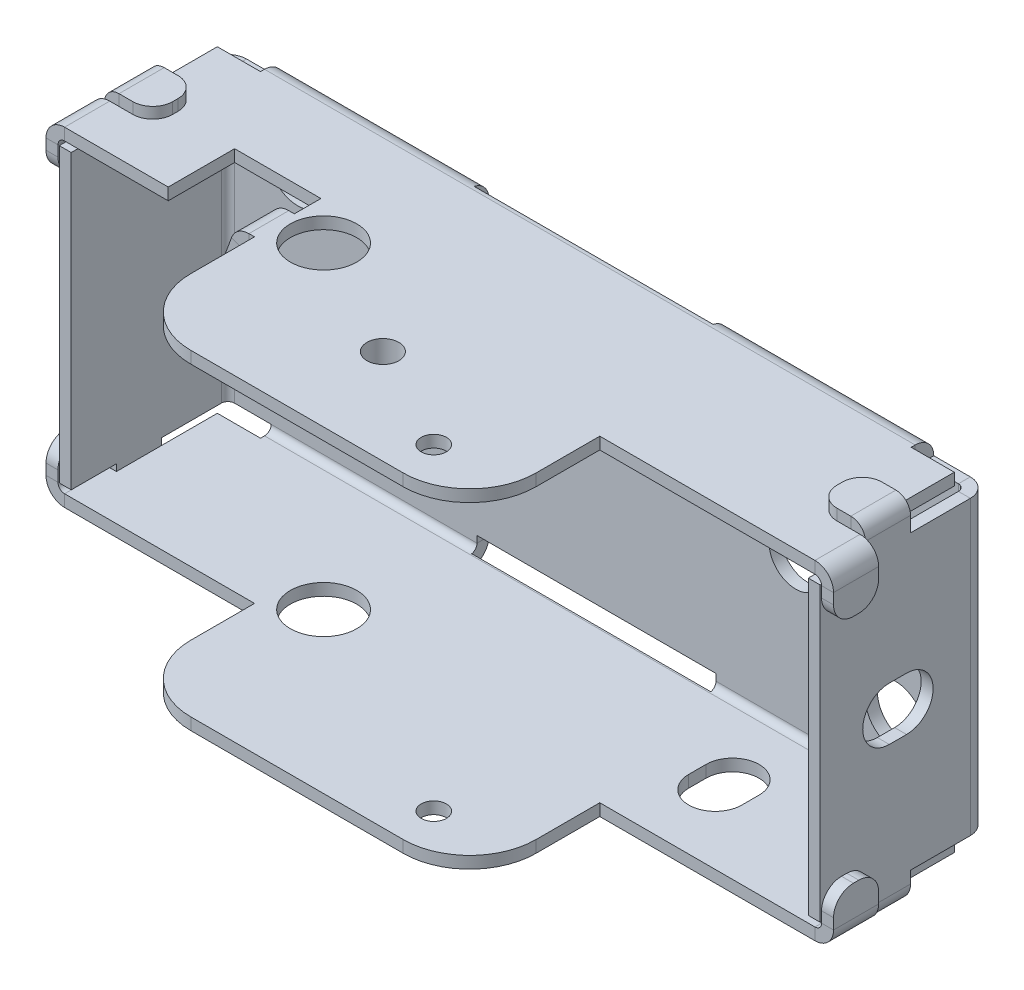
SolidWorks part; units mm, degrees
ref_plane "Plan de face" through (0, 0, 0) normal (0, 0, 1) x (1, 0, 0)
ref_plane "Plan de dessus" through (0, 0, 0) normal (0, 1, 0) x (1, 0, 0)
ref_plane "Plan de droite" through (0, 0, 0) normal (1, 0, 0) x (0, 0, -1)
sketch "Esquisse1" plane through (0, 0, 0) normal (0, 0, 1) x (1, 0, 0)
  line L0 (-24.5, 11) -> (-24.5, 12.8)
  line L1 (-32.05, -23.8) -> (-13.95, -23.8)
  line L2 (-24.5, -12.8) -> (-24.5, -11)
  line L3 (-32.05, 23.8) -> (-20.45, 23.8)
  line L4 (24.5, -12.8) -> (24.5, -11)
  line L5 (-24.5, 11) -> (-33.25, 11)
  line L6 (24.5, 11) -> (24.5, 12.8)
  line L7 (-24.5, -11) -> (-33.25, -11)
  line L8 (-40.05, 11) -> (-40.05, -11)
  line L9 (24.5, 11) -> (33.25, 11)
  line L10 (32.05, 23.8) -> (32.05, 20.4)
  line L11 (24.5, -11) -> (33.25, -11)
  line L12 (40.05, 11) -> (40.05, -11)
  line L13 (-32.05, 23.8) -> (-32.05, 20.4)
  line L14 (-27.75, 12.8) -> (-24.5, 12.8)
  line L15 (0, -23.8) -> (0, 23.8) construction
  line L16 (-32.05, -23.8) -> (-32.05, -20.4)
  line L17 (27.75, 12.8) -> (24.5, 12.8)
  line L18 (-27.75, -12.8) -> (-24.5, -12.8)
  line L19 (40.05, 0) -> (-40.05, 0) construction
  line L20 (32.05, -23.8) -> (32.05, -20.4)
  line L21 (27.75, -12.8) -> (24.5, -12.8)
  line L22 (-27.75, 12.8) -> (-27.75, 20.4)
  line L23 (-9, 10.5) -> (9, 10.5)
  line L24 (-9, 10.5) -> (-9, 12.3)
  line L25 (-9, 12.3) -> (9, 12.3)
  line L26 (9, 10.5) -> (9, 12.3)
  line L27 (-9, -10.5) -> (9, -10.5)
  line L28 (-9, -10.5) -> (-9, -12.3)
  line L29 (-9, -12.3) -> (9, -12.3)
  line L30 (9, -10.5) -> (9, -12.3)
  line L31 (-27.75, 20.4) -> (-32.05, 20.4)
  line L32 (-27.75, -12.8) -> (-27.75, -20.4)
  line L33 (-27.75, -20.4) -> (-32.05, -20.4)
  line L34 (27.75, 12.8) -> (27.75, 20.4)
  line L35 (27.75, 20.4) -> (32.05, 20.4)
  line L36 (27.75, -12.8) -> (27.75, -20.4)
  line L37 (27.75, -20.4) -> (32.05, -20.4)
  line L38 (-36.65, -11) -> (-40.05, -11)
  line L39 (-36.65, 11) -> (-40.05, 11)
  line L40 (-36.65, -11) -> (-36.65, -15.7)
  line L41 (-36.65, -15.7) -> (-33.25, -15.7)
  line L42 (-33.25, -11) -> (-33.25, -15.7)
  line L43 (36.65, 11) -> (40.05, 11)
  line L44 (-36.65, 11) -> (-36.65, 15.7)
  line L45 (-36.65, 15.7) -> (-33.25, 15.7)
  line L46 (-33.25, 11) -> (-33.25, 15.7)
  line L47 (36.65, -11) -> (40.05, -11)
  line L48 (36.65, 11) -> (36.65, 15.7)
  line L49 (36.65, 15.7) -> (33.25, 15.7)
  line L50 (33.25, 11) -> (33.25, 15.7)
  line L51 (0, 10.5) -> (0, -10.5) construction
  line L52 (36.65, -11) -> (36.65, -15.7)
  line L53 (36.65, -15.7) -> (33.25, -15.7)
  line L54 (33.25, -11) -> (33.25, -15.7)
  line L55 (12.05, -23.8) -> (32.05, -23.8)
  line L56 (-32.05, 23.8) -> (32.05, 23.8) construction
  line L57 (-13.95, 23.8) -> (-13.95, 33.6)
  line L58 (-13.95, 33.6) -> (12.05, 33.6)
  line L59 (12.05, 23.8) -> (12.05, 33.6)
  line L60 (12.05, 23.8) -> (32.05, 23.8)
  line L61 (-13.95, -23.8) -> (-13.95, -33.6)
  line L62 (-13.95, -33.6) -> (12.05, -33.6)
  line L63 (12.05, -23.8) -> (12.05, -33.6)
  line L64 (-10.95, 21.6) -> (-10.95, 0) construction
  line L65 (-10.95, 0) -> (-10.95, -21.6) construction
  line L66 (6.3488, -30.6) -> (6.3488, 0) construction
  line L67 (6.3488, 0) -> (6.3488, 30.6) construction
  line L68 (-19.45, 23.8) -> (-19.45, 20.8)
  line L69 (-19.45, 20.8) -> (-13.95, 20.8)
  line L70 (-13.95, 20.8) -> (-13.95, 18.8)
  line L71 (-13.95, 18.8) -> (-20.45, 18.8)
  line L72 (-20.45, 18.8) -> (-20.45, 23.8)
  line L73 (-19.45, 23.8) -> (-13.95, 23.8)
  line L74 (22.5, 6.5) -> (0, 6.5) construction
  line L75 (22.5, -6.5) -> (22.5, 0) construction
  line L76 (22.5, 0) -> (22.5, 6.5) construction
  line L77 (0, 6.5) -> (-22.5, 6.5) construction
  line L78 (-22.5, 6.5) -> (-15, 0) construction
  line L79 (22.5, -6.5) -> (15, 0) construction
  line L80 (36.85, 3.0349) -> (36.85, -3.0249) construction
  line L81 (31.55, -3.0249) -> (31.55, 3.5197) construction
  line L82 (17.5894, -20.6) -> (12.05, -20.6) construction
  line L83 (34.85, -2) -> (33.55, -2)
  line L84 (33.55, 2) -> (34.85, 2)
  line L85 (17.5894, -15.3) -> (12.05, -15.3) construction
  line L86 (13.55, -18.6) -> (13.55, -17.3)
  line L87 (17.55, -18.6) -> (17.55, -17.3)
  circle A0 centre (-10.95, 21.6) radius 2.5
  circle A1 centre (-10.95, -21.6) radius 2.5
  circle A2 centre (6.3488, 30.6) radius 0.95
  circle A3 centre (6.3488, -30.6) radius 0.95
  circle A4 centre (-15, 0) radius 2
  circle A5 centre (15, 0) radius 2
  circle A6 centre (22.5, -6.5) radius 2.25
  circle A7 centre (-22.5, 6.5) radius 2.25
  arc A8 (34.85, -2) -> (34.85, 2) centre (34.85, 0) ccw
  arc A9 (33.55, 2) -> (33.55, -2) centre (33.55, 0) ccw
  arc A10 (13.55, -18.6) -> (17.55, -18.6) centre (15.55, -18.6) ccw
  arc A11 (17.55, -17.3) -> (13.55, -17.3) centre (15.55, -17.3) ccw
  dimension "D24" = 4.5
  dimension "D26" = 4
  dimension "D28" = 4
  dimension "D33" = 4
  dimension "D38" = 1.9
  dimension "D39" = 5
  dimension "D1" = 22
  dimension "D2" = 49
  dimension "D3" = 11
  dimension "D4" = 12.8
  dimension "D5" = 15.55
  dimension "D6" = 3.4
  dimension "D7" = 55.5
  dimension "D8" = 64.1
  dimension "D9" = 3.4
  dimension "D10" = 3.4
  dimension "D11" = 4.7
  dimension "D12" = 21
  dimension "D13" = 9.8
  dimension "D14" = 21.3
  dimension "D15" = 18
  dimension "D16" = 26
  dimension "D17" = 39.8
  dimension "D18" = 3
  dimension "D19" = 6.5
  dimension "D20" = 2
  dimension "D21" = 1
  dimension "D22" = 45
  dimension "D23" = 13
  dimension "D25" = 30
  dimension "D27" = 3.2
  dimension "D29" = 5.3
  dimension "D30" = 3.2
  dimension "D31" = 5.3
  dimension "D32" = 3.5
  dimension "D34" = 12
  dimension "D35" = 3
  dimension "D36" = 3
  dimension "D37" = 19.5
extrude "Extrusion1" add sketch "Esquisse1" along normal blind 0.9
fillet "Congé1" radius 1.5 20 edges at (-19.45, 22.3, 0.9) (-19.45, 22.3, 0) (-32.05, -20.4, 0.45) (-33.25, -15.7, 0.45) (-36.65, -15.7, 0.45) (-36.65, 15.7, 0.45) (-33.25, 15.7, 0.45) (-32.05, 20.4, 0.45) (-32.05, 23.8, 0.45) (-19.45, 20.8, 0.45) (-19.45, 23.8, 0.45) (32.05, 23.8, 0.45) (32.05, 20.4, 0.45) (33.25, 15.7, 0.45) (36.65, 15.7, 0.45) (36.65, -15.7, 0.45) (33.25, -15.7, 0.45) (32.05, -20.4, 0.45) (32.05, -23.8, 0.45) (-32.05, -23.8, 0.45)
fillet "Congé2" radius 5 4 edges at (-13.95, 33.6, 0.45) (12.05, 33.6, 0.45) (12.05, -33.6, 0.45) (-13.95, -33.6, 0.45)
sheet metal parameters "Tôlerie 3" parameters "D1"=0.7366, "Epaisseur"=0.9
flatten bends "Dépliage 1" parameters "D1"=0
sketch "Esquisse-Angle1" plane through (0, 0, 0.9) normal (0, 0, 1) x (1, 0, 0)
process bends "Pliage 1" parameters "D1"=0.2
sketch "Esquisse-Plate1" plane through (0, 0, 0.9) normal (0, 0, 1) x (1, 0, 0)
  line L0 (-24.5, 12.8) -> (-24.5, 11) construction
  line L1 (-28, 11) -> (-28, -11)
  line L2 (-24.5, -11.75) -> (24.5, -11.75)
  line L3 (-29, 23.8) -> (-29, 20.4)
  line L4 (24.5, 11) -> (24.5, 12.8) construction
  line L5 (-24.5, 11.75) -> (24.5, 11.75)
  line L6 (-24.5, -11) -> (-24.5, -12.8) construction
  line L7 (-20.45, 23.8) -> (-30.55, 23.8) construction
  line L8 (24.5, -12.8) -> (24.5, -11) construction
  line L9 (-33.25, 11) -> (-33.25, 14.2) construction
  line L10 (-29, -20.4) -> (-29, -23.8)
  line L11 (0, 0) -> (-36.65, 0) construction
  line L12 (28, 11) -> (28, -11)
  line L13 (-30.55, -23.8) -> (-13.95, -23.8) construction
  line L14 (29, -20.4) -> (29, -23.8)
  line L15 (24.5, -11) -> (33.25, -11) construction
  line L16 (33.25, 11) -> (24.5, 11) construction
  line L17 (-33.25, -11) -> (-24.5, -11) construction
  line L18 (-24.5, 11) -> (-33.25, 11) construction
  line L19 (0, 11.75) -> (0, -11.75) construction
  line L20 (-28, 0) -> (28, 0) construction
  line L21 (36.65, 11) -> (36.65, 14.2) construction
  line L22 (29, 23.8) -> (29, 20.4)
  line L23 (-14.95, 23.8) -> (-14.95, 20.8)
  line L24 (-29, 23.8) -> (29, 23.8) construction
  line L25 (0, 0) -> (0, 23.8) construction
  line L26 (27.75, 20.4) -> (30.55, 20.4) construction
  line L27 (-30.55, 20.4) -> (-27.75, 20.4) construction
  line L28 (-27.75, -20.4) -> (-30.55, -20.4) construction
  line L29 (30.55, -20.4) -> (27.75, -20.4) construction
  line L30 (-36.65, 12.65) -> (-33.25, 12.65)
  line L31 (-17.95, 20.8) -> (-13.95, 20.8) construction
  line L32 (-13.95, 28.6) -> (-13.95, 23.8) construction
  line L33 (33.25, 12.65) -> (36.65, 12.65)
  line L34 (33.25, 14.2) -> (33.25, 11) construction
  line L36 (33.25, -12.65) -> (36.65, -12.65)
  line L39 (-36.65, -11) -> (-36.65, -14.2) construction
  line L40 (-36.65, -12.65) -> (-33.25, -12.65)
  line L41 (-33.25, -14.2) -> (-33.25, -11) construction
  line L42 (33.25, -11) -> (33.25, -14.2) construction
  line L43 (36.65, -14.2) -> (36.65, -11) construction
  line L45 (-36.65, -12.65) -> (-36.65, 12.65) construction
  point P2 (23.6, 0)
  dimension "D1" = 23.5
  dimension "D2" = 58
  dimension "D3" = 56
  dimension "D4" = 25.3
  dimension "D5" = 1
bend "Pli défini à plat7" bend radius 0.5 bend angle 90 parameters "D5"=1
bend "Pli défini à plat8" bend radius 0.5 bend angle 90 parameters "D5"=2
bend "Pli défini à plat9" bend radius 0.5 bend angle 90 parameters "D5"=3
bend "Pli défini à plat10" bend radius 0.5 bend angle 90 parameters "D5"=4
bend "Pli défini à plat11" bend radius 0.5 bend angle 90 parameters "D5"=5
bend "Pli défini à plat12" bend radius 0.5 bend angle 90 parameters "D5"=6
bend "Pli défini à plat13" bend radius 0.5 bend angle 90 parameters "D5"=7
bend "Pli défini à plat14" bend radius 0.5 bend angle 90 parameters "D5"=8
bend "Pli défini à plat15" bend angle 90 parameters "D1"=0, "D5"=9
bend "Pli défini à plat16" bend angle 90 parameters "D1"=0, "D5"=10
bend "Pli défini à plat17" bend radius 0.5 bend angle 90 parameters "D5"=11
bend "Pli défini à plat18" bend radius 0.5 bend angle 90 parameters "D5"=12
bend "Pli défini à plat19" bend radius 0.5 bend angle 70 parameters "D5"=13
ref_plane "Plan1" through (0, 5.9039, 0) normal (0, 1, 0) x (-1, 0, 0)
sketch "Esquisse2" plane through (0, 5.9039, 0) normal (0, 1, 0) x (-1, 0, 0)
  line L0 (2.6539, 3.9) -> (12.6539, 3.9) construction
  line L1 (-9, 0) -> (9, 0) construction
  line L2 (2.6539, 3.9) -> (2.6539, 0) construction
  line L3 (12.6539, 3.9) -> (12.6539, 0) construction
  line L4 (24.5, 0) -> (9, 0) construction
  line L5 (28.6539, 5.9039) -> (28.6539, 1.4) construction
  line L6 (1.7303, 0) -> (2.6539, 0)
  line L7 (12.6539, 0) -> (13.5775, 0)
  arc A0 (12.6539, 0) -> (2.6539, 0) centre (7.6539, -1.2551) ccw
  arc A1 (13.5775, 0) -> (1.7303, 0) centre (7.6539, -1.2551) ccw
  dimension "D4" = 0.9
  dimension "D1" = 3.9
  dimension "D2" = 10
  dimension "D3" = 16
extrude "Extrusion3" add sketch "Esquisse2" against normal blind 3.3
sketch "Esquisse4" plane through (0, 5.9039, 0) normal (0, 1, 0) x (-1, 0, 0)
  line L0 (2.9708, 0.9) -> (12.3369, 0.9)
  arc A0 (2.9708, 0.9) -> (12.3369, 0.9) centre (7.6539, -1.2551) ccw
  arc A1 (12.6539, 0) -> (2.6539, 0) centre (7.6539, -1.2551) ccw construction
extrude "Enlèv. mat.-Extru.5" cut sketch "Esquisse4" against normal blind 3.3
fillet "Congé3" radius 0.9 4 edges at (-13.3125, 4.2539, 0.9) (-1.9953, 4.2539, 0.9) (-12.6539, 4.2539, 0) (-2.6539, 4.2539, 0)
sketch "Esquisse6" plane through (0, 11.5039, 0) normal (0, -1, 0) x (1, 0, 0)
  line L2 (-10.95, 10.5039) -> (6.3488, 19.5039) construction
  circle A0 centre (-1.6352, 15.35) radius 1.95
  dimension "D1" = 3.9
  dimension "D2" = 10.5
extrude "Extrusion4" add sketch "Esquisse6" along normal blind 2
sketch "Esquisse5" plane through (0, 11.5039, 0) normal (0, -1, 0) x (1, 0, 0)
  circle A0 centre (-1.6352, 15.35) radius 1.2
  circle A1 centre (-1.6352, 15.35) radius 1.95 construction
  dimension "D1" = 2.4
extrude "Enlèv. mat.-Extru.7" cut sketch "Esquisse5" against normal mid plane 10.9
